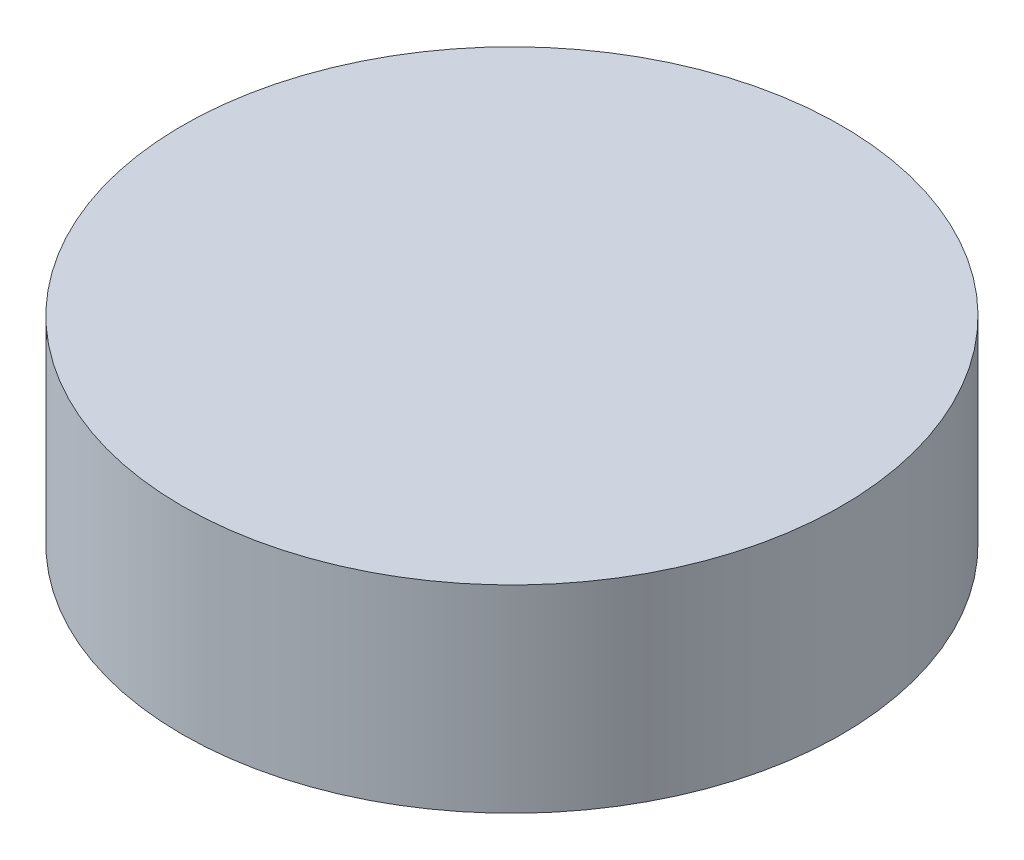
SolidWorks part; units mm, degrees
ref_plane "Front" through (0, 0, 0) normal (0, 0, 1) x (1, 0, 0)
ref_plane "Top" through (0, 0, 0) normal (0, 1, 0) x (1, 0, 0)
ref_plane "Right" through (0, 0, 0) normal (1, 0, 0) x (0, 0, -1)
sketch "Sketch1" plane through (0, 0, 0) normal (0, 1, 0) x (1, 0, 0)
  circle A0 centre (0, 0) radius 50
  dimension "D1" = 100
extrude "Extrude1" add sketch "Sketch1" along normal blind 30
